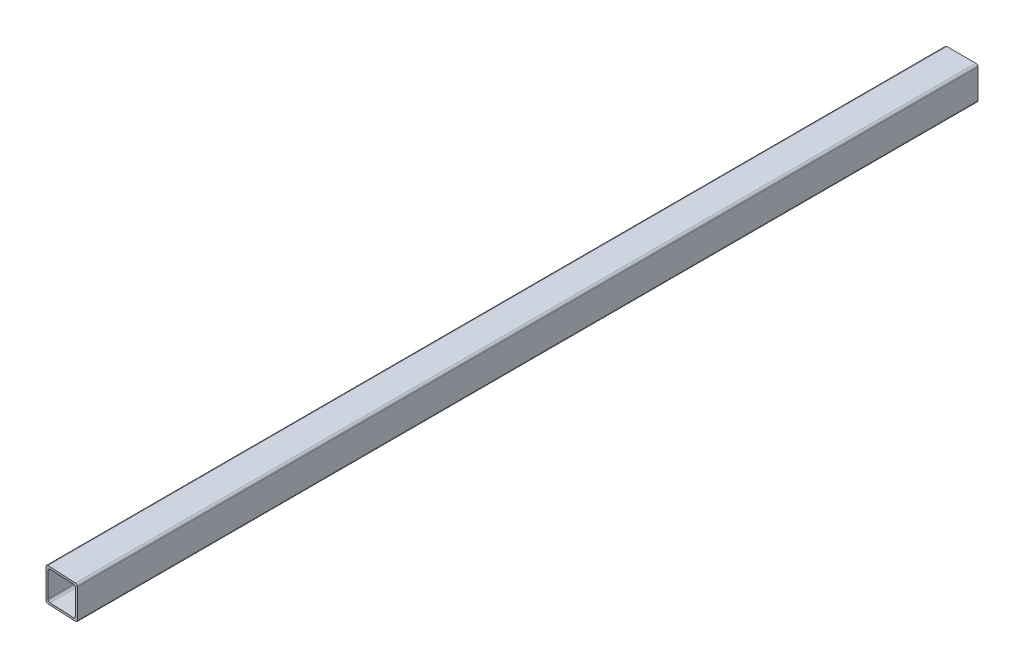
SolidWorks part; units mm, degrees
ref_plane "Plan de face" through (0, 0, 0) normal (0, 0, 1) x (1, 0, 0)
ref_plane "Plan de dessus" through (0, 0, 0) normal (0, 1, 0) x (1, 0, 0)
ref_plane "Plan de droite" through (0, 0, 0) normal (1, 0, 0) x (0, 0, -1)
sketch "Esquisse1" plane through (0, 0, 0) normal (0, 0, 1) x (1, 0, 0)
  line L4 (35, 40) -> (-35, 40)
  line L5 (40, -35) -> (40, 35)
  line L6 (-35, -40) -> (35, -40)
  line L7 (-40, 35) -> (-40, -35)
  line L8 (35, 40) -> (-35, 40)
  line L9 (40, -35) -> (40, 35)
  line L10 (-35, -40) -> (35, -40)
  line L11 (-40, 35) -> (-40, -35)
  line L12 (30, 35) -> (-30, 35)
  line L13 (-35, 30) -> (-35, -30)
  line L14 (-30, -35) -> (30, -35)
  line L15 (35, -30) -> (35, 30)
  line L16 (30, 35) -> (-30, 35)
  line L17 (-35, 30) -> (-35, -30)
  line L18 (-30, -35) -> (30, -35)
  line L19 (35, -30) -> (35, 30)
  arc A4 (40, 35) -> (35, 40) centre (35, 35) ccw
  arc A5 (35, -40) -> (40, -35) centre (35, -35) ccw
  arc A6 (-40, -35) -> (-35, -40) centre (-35, -35) ccw
  arc A7 (-35, 40) -> (-40, 35) centre (-35, 35) ccw
  arc A8 (40, 35) -> (35, 40) centre (35, 35) ccw
  arc A9 (35, -40) -> (40, -35) centre (35, -35) ccw
  arc A10 (-40, -35) -> (-35, -40) centre (-35, -35) ccw
  arc A11 (-35, 40) -> (-40, 35) centre (-35, 35) ccw
  arc A12 (-30, 35) -> (-35, 30) centre (-30, 30) ccw
  arc A13 (-35, -30) -> (-30, -35) centre (-30, -30) ccw
  arc A14 (30, -35) -> (35, -30) centre (30, -30) ccw
  arc A15 (35, 30) -> (30, 35) centre (30, 30) ccw
  arc A16 (-30, 35) -> (-35, 30) centre (-30, 30) ccw
  arc A17 (-35, -30) -> (-30, -35) centre (-30, -30) ccw
  arc A18 (30, -35) -> (35, -30) centre (30, -30) ccw
  arc A19 (35, 30) -> (30, 35) centre (30, 30) ccw
  dimension "D1" = 0
  dimension "D2" = 0
extrude "Boss.-Extru.1" add sketch "Esquisse1" along normal up to surface (2169.7497 mm away)
